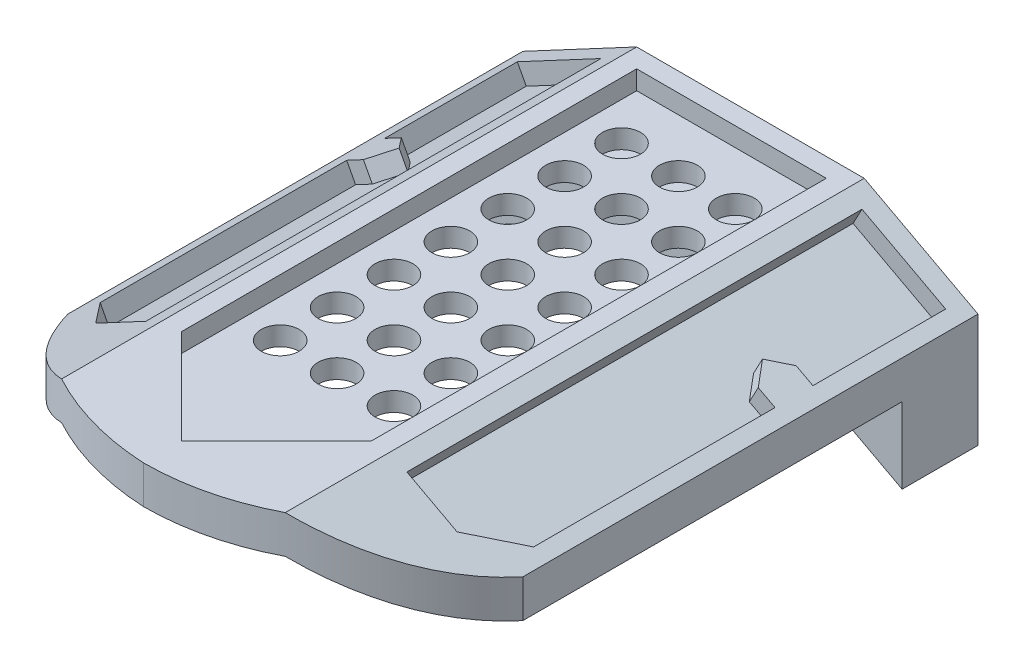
SolidWorks part; units mm, degrees
ref_plane "Front Plane" through (0, 0, 0) normal (0, 0, 1) x (1, 0, 0)
ref_plane "Top Plane" through (0, 0, 0) normal (0, 1, 0) x (1, 0, 0)
ref_plane "Right Plane" through (0, 0, 0) normal (1, 0, 0) x (0, 0, -1)
sketch "Sketch1" plane through (0, 0, 0) normal (0, 0, 1) x (1, 0, 0)
  line L0 (0, 0) -> (0, 12.7)
  line L1 (152.4, 0) -> (152.4, 12.7)
  line L2 (0, 12.7) -> (38.1, 33.02)
  line L3 (38.1, 33.02) -> (114.3, 33.02)
  line L4 (114.3, 33.02) -> (152.4, 12.7)
  line L5 (152.4, 0) -> (114.3, 20.32)
  line L6 (114.3, 20.32) -> (38.1, 20.32)
  line L7 (38.1, 20.32) -> (0, 0)
  dimension "D4" = 38.1
  dimension "D3" = 38.1
  dimension "D1" = 12.7
  dimension "D2" = 12.7
  dimension "D5" = 152.4
  dimension "D6" = 38.1
  dimension "D7" = 38.1
  dimension "D8" = 12.7
  dimension "D9" = 12.7
  dimension "D10" = 20.32
  dimension "D11" = 20.32
extrude "Boss-Extrude1" add sketch "Sketch1" along normal blind 203.2
sketch "Sketch5" plane through (0, 33.02, 0) normal (0, 1, 0) x (1, 0, 0)
  line L0 (0, -152.4) -> (0, -203.2)
  line L1 (0, -203.2) -> (0, 0) construction
  line L2 (0, -203.2) -> (76.2, -203.2)
  line L3 (114.3, -203.2) -> (38.1, -203.2) construction
  arc A0 (76.2, -203.2) -> (0, -152.4) centre (80.4914, -114.213) cw
  dimension "D1" = 50.8
extrude "Cut-Extrude1" cut sketch "Sketch5" against normal blind 60.96
sketch "Sketch6" plane through (0, 33.02, 0) normal (0, 1, 0) x (1, 0, 0)
  line L0 (76.2, -203.2) -> (152.4, -203.2)
  line L1 (152.4, -203.2) -> (152.4, -152.4)
  line L2 (152.4, -203.2) -> (152.4, 0) construction
  arc A0 (76.2, -203.2) -> (152.4, -152.4) centre (76.2, -120.65) ccw
  dimension "D1" = 50.8
extrude "Cut-Extrude2" cut sketch "Sketch6" against normal blind 60.96
sketch "Sketch7" plane through (-5.2734, 9.8875, 0) normal (-0.4706, 0.8824, 0) x (0.8824, 0.4706, 0)
  line L0 (49.1565, 0) -> (5.9765, 0) construction
  line L2 (11.0565, -6.35) -> (11.0565, -50.8)
  line L3 (11.0565, -50.8) -> (17.4065, -50.8)
  line L4 (17.4065, -50.8) -> (23.7565, -57.15)
  line L5 (23.7565, -57.15) -> (17.4065, -63.5)
  line L6 (17.4065, -63.5) -> (11.0565, -63.5)
  line L7 (11.0565, -63.5) -> (11.0565, -146.05)
  line L8 (11.0565, -146.05) -> (23.7565, -158.75)
  line L9 (23.7565, -158.75) -> (42.8065, -158.75)
  line L10 (42.8065, -158.75) -> (42.8065, -6.35)
  line L11 (42.8065, -6.35) -> (11.0565, -6.35)
  line L12 (49.1565, -192.5716) -> (49.1565, 0) construction
  point P14 (14.2315, -50.8)
  dimension "D1" = 152.4
  dimension "D2" = 6.35
  dimension "D3" = 6.35
  dimension "D4" = 31.75
  dimension "D5" = 31.75
  dimension "D6" = 19.05
  dimension "D7" = 6.35
  dimension "D8" = 6.35
  dimension "D9" = 12.7
  dimension "D10" = 6.35
  dimension "D11" = 44.45
extrude "Cut-Extrude3" cut sketch "Sketch7" against normal blind 6.35
sketch "Sketch8" plane through (39.0228, 73.1678, 0) normal (0.4706, 0.8824, 0) x (0.8824, -0.4706, 0)
  line L0 (91.6641, -6.35) -> (91.6641, -158.75)
  line L1 (91.6641, -158.75) -> (110.7141, -158.75)
  line L2 (110.7141, -158.75) -> (123.4141, -144.3343)
  line L3 (123.4141, -144.3343) -> (123.4141, -63.5)
  line L4 (123.4141, -63.5) -> (117.0641, -63.5)
  line L5 (117.0641, -63.5) -> (111.4699, -57.15)
  line L6 (111.4699, -57.15) -> (117.0641, -50.8)
  line L7 (117.0641, -50.8) -> (123.4141, -50.8)
  line L8 (123.4141, -50.8) -> (123.4141, -6.35)
  line L9 (123.4141, -6.35) -> (91.6641, -6.35)
  line L10 (85.3141, -193.8818) -> (85.3141, 0) construction
  line L11 (128.4941, 0) -> (85.3141, 0) construction
  dimension "D1" = 6.35
  dimension "D2" = 31.75
  dimension "D3" = 152.4
  dimension "D4" = 31.75
  dimension "D5" = 6.35
  dimension "D6" = 19.05
  dimension "D7" = 6.35
  dimension "D8" = 6.35
  dimension "D9" = 6.35
  dimension "D10" = 12.7
  dimension "D11" = 44.45
extrude "Cut-Extrude4" cut sketch "Sketch8" against normal blind 6.35
sketch "Sketch9" plane through (0, 33.02, 0) normal (0, 1, 0) x (1, 0, 0)
  line L0 (44.45, -6.35) -> (107.95, -6.35)
  line L1 (44.45, -6.35) -> (44.45, -158.75)
  line L2 (107.95, -6.35) -> (107.95, -158.75)
  line L3 (44.45, -158.75) -> (107.95, -158.75)
  line L4 (114.3, -193.8818) -> (114.3, 0) construction
  line L5 (114.3, 0) -> (38.1, 0) construction
  dimension "D1" = 63.5
  dimension "D2" = 6.35
  dimension "D3" = 6.35
  dimension "D4" = 152.4
extrude "Cut-Extrude5" cut sketch "Sketch9" against normal blind 6.35
sketch "Sketch10" plane through (0, 33.02, 0) normal (0, 1, 0) x (1, 0, 0)
  line L0 (44.45, -158.75) -> (107.95, -158.75)
  line L1 (107.95, -158.75) -> (76.2, -190.5)
  line L2 (76.2, -190.5) -> (44.45, -158.75)
extrude "Cut-Extrude6" cut sketch "Sketch10" against normal blind 6.35
sketch "Sketch11" plane through (0, 26.67, 0) normal (0, 1, 0) x (1, 0, 0)
  line L0 (107.95, -6.35) -> (44.45, -6.35) construction
  line L1 (44.45, -6.35) -> (44.45, -158.75) construction
  circle A0 centre (57.15, -24.13) radius 6.35
  circle A1 centre (76.2, -24.13) radius 6.35
  circle A2 centre (95.25, -24.13) radius 6.35
  circle A3 centre (76.2, -43.18) radius 6.35
  circle A4 centre (95.25, -43.18) radius 6.35
  circle A5 centre (76.2, -62.23) radius 6.35
  circle A6 centre (95.25, -62.23) radius 6.35
  circle A7 centre (76.2, -81.28) radius 6.35
  circle A8 centre (95.25, -81.28) radius 6.35
  circle A9 centre (76.2, -100.33) radius 6.35
  circle A10 centre (95.25, -100.33) radius 6.35
  circle A11 centre (76.2, -119.38) radius 6.35
  circle A12 centre (95.25, -119.38) radius 6.35
  circle A13 centre (76.2, -138.43) radius 6.35
  circle A14 centre (95.25, -138.43) radius 6.35
  circle A15 centre (57.15, -43.18) radius 6.35
  circle A16 centre (57.15, -62.23) radius 6.35
  circle A17 centre (57.15, -81.28) radius 6.35
  circle A18 centre (57.15, -100.33) radius 6.35
  circle A19 centre (57.15, -119.38) radius 6.35
  circle A20 centre (57.15, -138.43) radius 6.35
  dimension "D1" = 12.7
  dimension "D4" = 17.78
  dimension "D5" = 12.7
  dimension "D2" = 3
  dimension "D3" = 7
extrude "Cut-Extrude7" cut sketch "Sketch11" against normal blind 6.35
sketch "Sketch12" plane through (0, 0, 0) normal (0, 0, -1) x (-1, 0, 0)
  line L0 (-152.4, 0) -> (-114.3, 20.32)
  line L1 (-114.3, 20.32) -> (-38.1, 20.32)
  line L2 (-38.1, 20.32) -> (0, 0)
  line L3 (0, 0) -> (0, -25.4)
  line L4 (0, -25.4) -> (-38.1, -5.08)
  line L5 (-38.1, -5.08) -> (-114.3, -5.08)
  line L6 (-114.3, -5.08) -> (-152.4, -25.4)
  line L7 (-152.4, -25.4) -> (-152.4, 0)
  dimension "D1" = 25.4
  dimension "D2" = 25.4
  dimension "D3" = 25.4
  dimension "D4" = 25.4
extrude "Boss-Extrude2" add sketch "Sketch12" against normal blind 25.4
